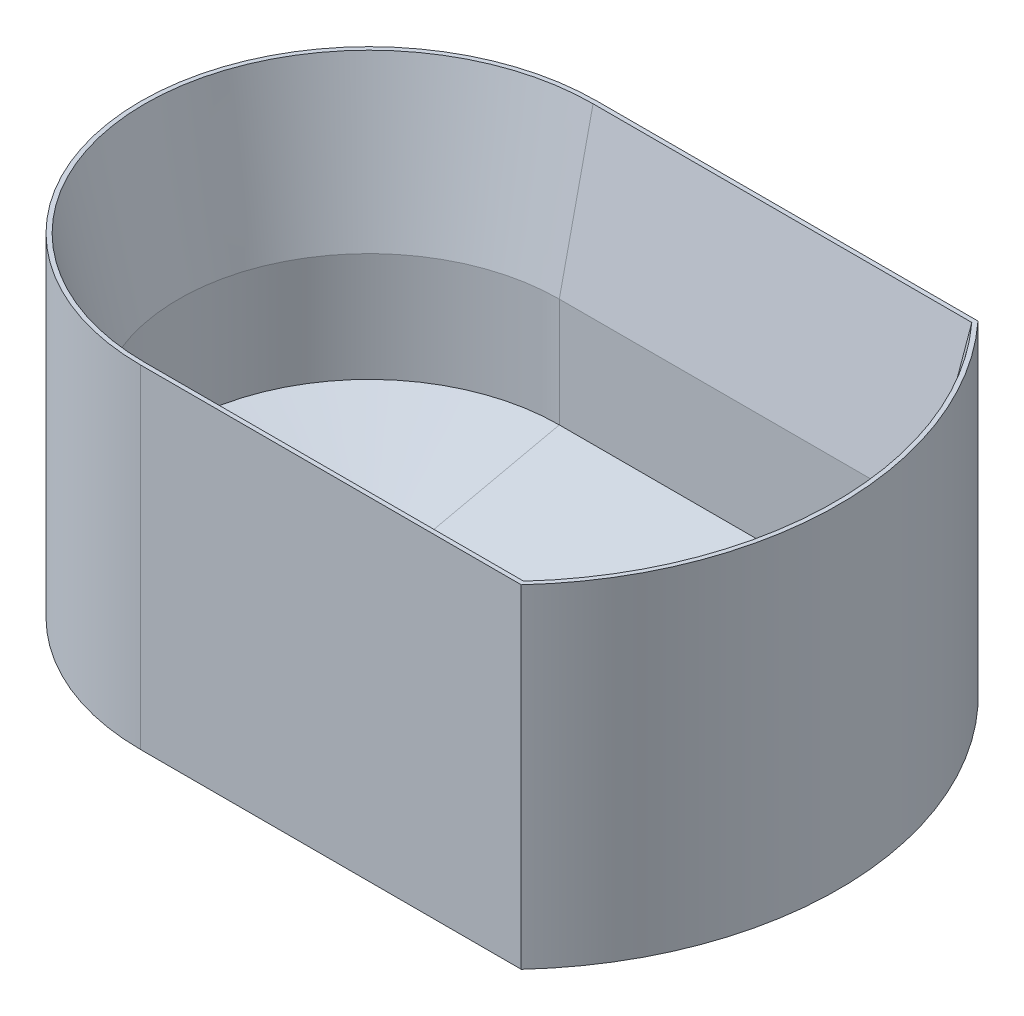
SolidWorks part; units mm, degrees
ref_plane "Front Plane" through (0, 0, 0) normal (0, 0, 1) x (1, 0, 0)
ref_plane "Top Plane" through (0, 0, 0) normal (0, 1, 0) x (1, 0, 0)
ref_plane "Right Plane" through (0, 0, 0) normal (1, 0, 0) x (0, 0, -1)
sketch "Sketch1" plane through (0, 0, 0) normal (0, 1, 0) x (1, 0, 0)
  line L1 (0, 0) -> (50.8, 0)
  line L2 (0, 0) -> (0, 60.96)
  line L3 (0, 60.96) -> (50.8, 60.96)
  line L4 (50.8, 0) -> (50.8, 60.96)
  arc A0 (0, 60.96) -> (0, 0) centre (0, 30.48) ccw
  arc A1 (50.8, 60.96) -> (50.8, 0) centre (17.8289, 30.48) cw
  dimension "D1" = 60.96
  dimension "D2" = 50.8
extrude "Boss-Extrude1" add sketch "Sketch1" along normal blind 44.45 contours L2 A0 | L1 L4 L3 L2 | A1 L4
shell "Shell1" thickness 5.08
chamfer "Chamfer2" distance 20.32 angle 12.5 8 edges at (24.2488, 5.08, -5.08) (-25.4, 5.08, -30.48) (57.6502, 5.08, -30.48) (24.2488, 5.08, -55.88) (24.2488, 44.45, -5.08) (-25.4, 44.45, -30.48) (24.2488, 44.45, -55.88) (57.6502, 44.45, -30.48)
